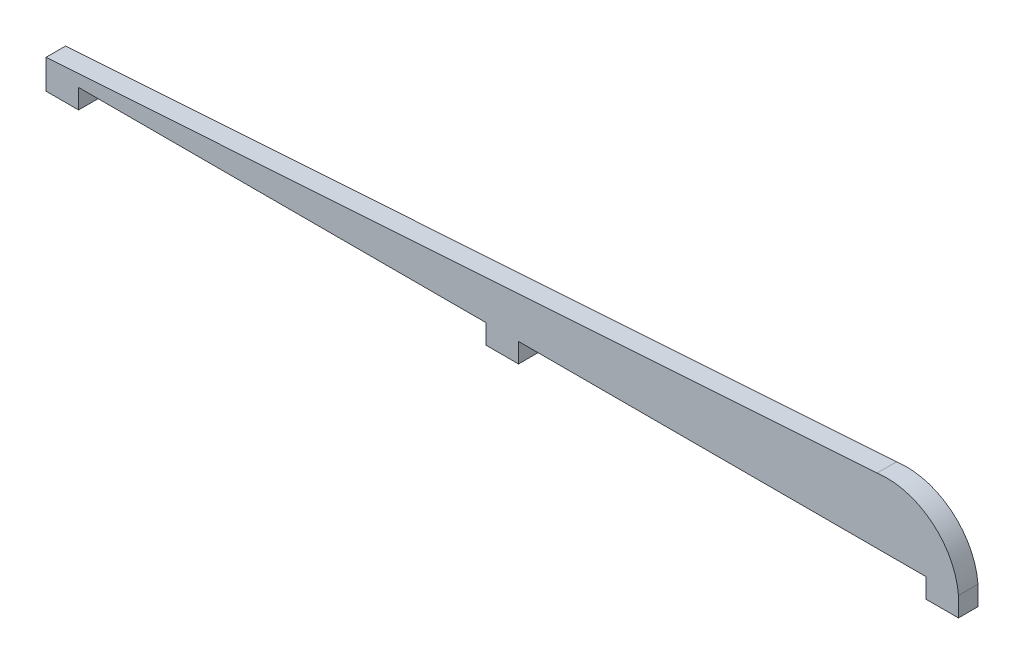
SolidWorks part; units mm, degrees
ref_plane "Front Plane" through (0, 0, 0) normal (0, 0, 1) x (1, 0, 0)
ref_plane "Top Plane" through (0, 0, 0) normal (0, 1, 0) x (1, 0, 0)
ref_plane "Right Plane" through (0, 0, 0) normal (1, 0, 0) x (0, 0, -1)
sketch "Sketch1" plane through (0, 0, 0) normal (0, 0, 1) x (1, 0, 0)
  line L0 (0, -1265.479) -> (0, 62008.4733) construction
  line L1 (-1265.479, 0) -> (130, 0) construction
  line L2 (140, 0) -> (140, -6)
  line L3 (-130, 0) -> (-5, 0)
  line L4 (-140, 0) -> (-140, 3)
  line L5 (-140, 3) -> (115, 20)
  line L6 (140, 0) -> (62008.4733, 0) construction
  line L8 (-140, 0) -> (-140, -6)
  line L9 (-140, -6) -> (-130, -6)
  line L10 (-130, 0) -> (-130, -6)
  line L12 (-5, 0) -> (-5, -6)
  line L13 (-5, -6) -> (5, -6)
  line L14 (5, 0) -> (5, -6)
  line L15 (130, 0) -> (130, -6)
  line L16 (140, -6) -> (130, -6)
  line L17 (115, 21.704) -> (115, -21.704) construction
  line L18 (5, 0) -> (130, 0)
  arc A0 (140, 0) -> (115, 20) centre (118.0871, -1.7661) ccw
  point P22 (115, 0)
  dimension "D1" = 280
  dimension "D2" = 20
  dimension "D3" = 10
  dimension "D4" = 6
  dimension "D5" = 6
  dimension "D6" = 10
  dimension "D7" = 3
extrude "Boss-Extrude1" add sketch "Sketch1" along normal blind 6
